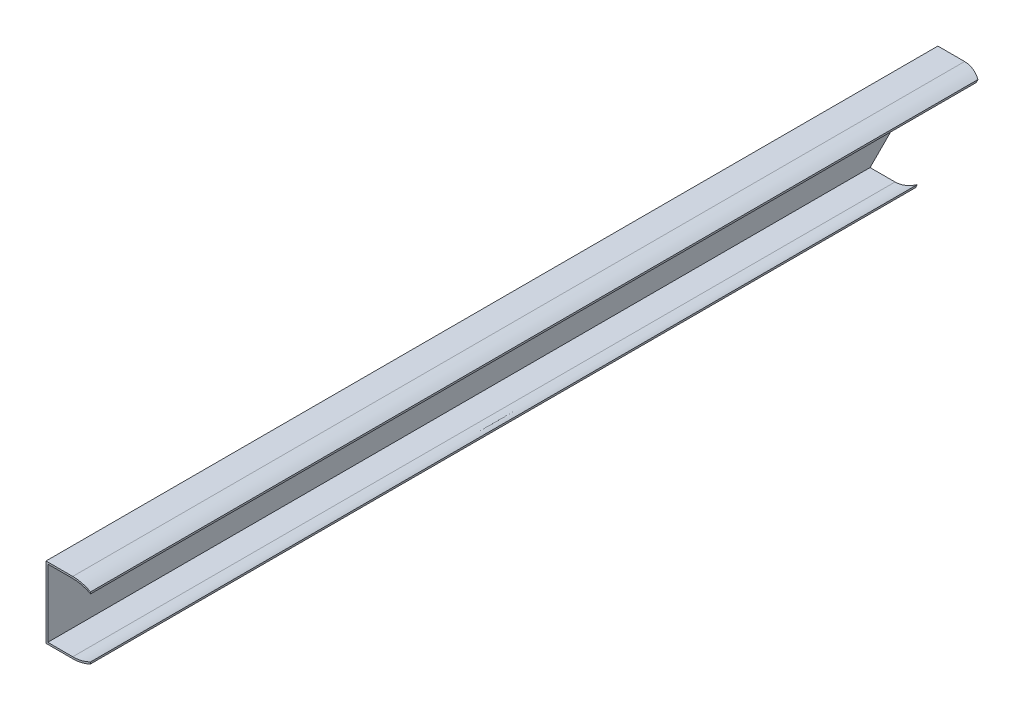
SolidWorks part; units mm, degrees
ref_plane "Plan de face" through (0, 0, 0) normal (0, 0, 1) x (1, 0, 0)
ref_plane "Plan de dessus" through (0, 0, 0) normal (0, 1, 0) x (1, 0, 0)
ref_plane "Plan de droite" through (0, 0, 0) normal (1, 0, 0) x (0, 0, -1)
sketch "Esquisse1" plane through (0, 0, 0) normal (0, 0, 1) x (1, 0, 0)
  line L0 (0, 0) -> (0, 80)
  line L1 (0, 80) -> (30, 80)
  line L2 (0, 40) -> (81.0721, 40) construction
  line L3 (2, 78) -> (2, 2)
  line L4 (0, 0) -> (30, 0)
  line L5 (2, 78) -> (30, 78)
  line L6 (50, 75) -> (50, 73)
  line L7 (50, 5) -> (50, 7)
  line L8 (2, 2) -> (30, 2)
  spline S0 degree 2 poles (30, 80) (40.6033, 79.9515) (50, 75) knots 0 0 0 1 1 1
  spline S1 degree 2 poles (30, 0) (40.6033, 0.0485) (50, 5) knots 0 0 0 1 1 1
  spline S2 degree 2 poles (30, 78) (40.6033, 77.9515) (50, 73) knots 0 0 0 1 1 1
  spline S3 degree 2 poles (30, 2) (40.6033, 2.0485) (50, 7) knots 0 0 0 1 1 1
  point P20 (2, 40)
  dimension "D1" = 80
  dimension "D2" = 30
  dimension "D3" = 5
  dimension "D4" = 50
  dimension "D5" = 1.2
  dimension "D6" = 10
  dimension "D7" = 5
  dimension "D8" = 10
  dimension "D9" = 1.2
  dimension "D10" = 28
  dimension "D11" = 20
  dimension "D12" = 2
  dimension "D13" = 2
extrude "Extrusion1" add sketch "Esquisse1" along normal blind 1000
sketch "Esquisse4" plane through (0, 0, 0) normal (-1, 0, 0) x (0, 0, 1)
  line L1 (1000, 0) -> (0, 0) construction
  line L2 (0, 0) -> (80, 0)
  line L5 (80, 0) -> (0, 80)
  line L6 (0, 80) -> (0, 0)
  dimension "D2" = 45
extrude "Extrusion5" cut sketch "Esquisse4" against normal up to next
